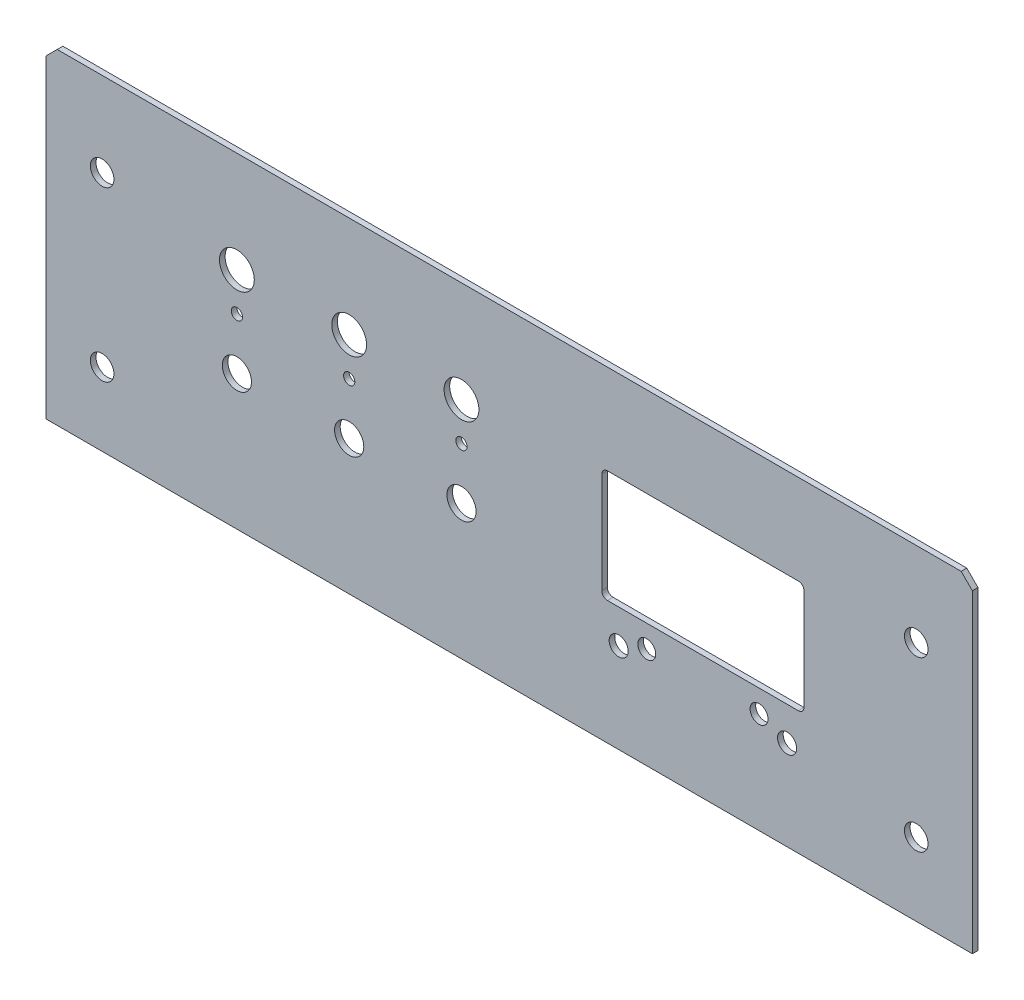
SolidWorks part; units mm, degrees
ref_plane "Front Plane" through (0, 0, 0) normal (0, 0, 1) x (1, 0, 0)
ref_plane "Top Plane" through (0, 0, 0) normal (0, 1, 0) x (1, 0, 0)
ref_plane "Right Plane" through (0, 0, 0) normal (1, 0, 0) x (0, 0, -1)
sketch "Sketch1" plane through (0, 0, 0) normal (0, 0, 1) x (1, 0, 0)
  line L0 (-80.5, 29) -> (-82.5, 27)
  line L1 (-80.5, 29) -> (80.5, 29)
  line L2 (-82.5, 27) -> (-82.5, -29)
  line L3 (-82.5, -29) -> (82.5, -29)
  line L4 (82.5, 27) -> (82.5, -29)
  line L5 (-82.5, 29) -> (82.5, -29) construction
  line L6 (-82.5, -29) -> (82.5, 29) construction
  line L7 (80.5, 29) -> (82.5, 27)
  point P0 (0, 0)
  dimension "D1" = 58
  dimension "D2" = 165
base flange "Base-Flange1" sketch "Sketch1" thickness 1 reverse thickness direction no parameters "D1"=0.7366
sketch "Sketch2" plane through (0, 0, -1) normal (0, 0, -1) x (-1, 0, 0)
  line L0 (-82.5, -29) -> (-82.5, 27) construction
  line L1 (-75, -26) -> (-60, -26) construction
  line L2 (82.5, 27) -> (82.5, -29) construction
  circle A2 centre (72.5, -16) radius 2.1
  circle A3 centre (-72.5, -16) radius 2.1
  circle A4 centre (-72.5, 14) radius 2.1
  circle A5 centre (72.5, 14) radius 2.1
  dimension "D1" = 4.2
  dimension "D2" = 10
  dimension "D3" = 10
  dimension "D4" = 10
  dimension "D5" = 30
extrude "Cut-Extrude1" cut sketch "Sketch2" against normal up to next
sketch "Sketch3" plane through (0, 0, 0) normal (0, 0, 1) x (1, 0, 0)
  line L0 (80.5, 29) -> (-80.5, 29) construction
  line L1 (17.5, 13) -> (51.5, 13)
  line L2 (16.5, 12) -> (16.5, -6)
  line L3 (17.5, -7) -> (51.5, -7)
  line L4 (52.5, 12) -> (52.5, -6)
  line L5 (16.5, 13) -> (52.5, -7) construction
  line L6 (16.5, -7) -> (52.5, 13) construction
  line L7 (-82.5, 27) -> (-82.5, -29) construction
  line L8 (82.5, -29) -> (82.5, 27) construction
  circle A0 centre (-48.5, 11) radius 3.1
  circle A1 centre (-28.5, -5) radius 2.6
  circle A2 centre (-48.5, -5) radius 2.6
  circle A3 centre (-28.5, 4.2) radius 1
  circle A4 centre (24.5, -11) radius 1.6
  circle A5 centre (44.5, -11) radius 1.6
  arc A6 (51.5, 13) -> (52.5, 12) centre (51.5, 12) cw
  arc A7 (52.5, -6) -> (51.5, -7) centre (51.5, -6) cw
  arc A8 (17.5, -7) -> (16.5, -6) centre (17.5, -6) cw
  arc A9 (16.5, 12) -> (17.5, 13) centre (17.5, 12) cw
  circle A10 centre (-48.5, 4.2) radius 1
  circle A11 centre (-28.5, 11) radius 3.1
  circle A12 centre (49.5, -13) radius 1.7
  circle A13 centre (19.5, -13) radius 1.7
  circle A14 centre (-8.5, -5) radius 2.6
  circle A15 centre (-8.5, 4.2) radius 1
  circle A16 centre (-8.5, 11) radius 3.1
  point P12 (34.5, 3)
  dimension "D1" = 6.2
  dimension "D6" = 5.2
  dimension "D12" = 3.2
  dimension "D15" = 1
  dimension "D16" = 2
  dimension "D18" = 3.4
  dimension "D2" = 18
  dimension "D3" = 34
  dimension "D4" = 3
  dimension "D5" = 16
  dimension "D7" = 36
  dimension "D8" = 20
  dimension "D9" = 48
  dimension "D10" = 20
  dimension "D11" = 24
  dimension "D13" = 10
  dimension "D14" = 16
  dimension "D17" = 6.8
  dimension "D19" = 15
  dimension "D20" = 15
  dimension "D21" = 6
  dimension "D22" = 20
extrude "Cut-Extrude2" cut sketch "Sketch3" against normal up to next
sketch "Bend-Lines1" [suppressed] plane through (0, 0, 0) normal (0, 1, 0) x (1, 0, 0)
sketch "Bounding-Box1" [suppressed] plane through (0, 0, 0) normal (0, 1, 0) x (1, 0, 0)
sheet metal parameters "Sheet-Metal1" thickness 1 parameters "D1"=0.7366
flat pattern "Flat-Pattern1"
sketch "Bend-Lines2" plane through (0, 0, 0) normal (0, 1, 0) x (1, 0, 0)
sketch3d "Bounding-Box2" [suppressed]
  line L0 (-75, -28.5, 0) -> (75, -28.5, 0) construction
  line L1 (-75, 28.5, 0) -> (75, 28.5, 0) construction
  line L2 (-75, -28.5, 0) -> (-75, 28.5, 0) construction
  line L3 (75, -28.5, 0) -> (75, 28.5, 0) construction
sheet metal parameters "Sheet-Metal2" thickness 1 parameters "D1"=0.7366
flat pattern "Flat-Pattern1"
sketch "Bend-Lines2" plane through (0, 0, 0) normal (0, 1, 0) x (1, 0, 0)
sketch3d "Bounding-Box2" [suppressed]
  line L0 (-75, -28.5, 0) -> (75, -28.5, 0) construction
  line L1 (-75, 28.5, 0) -> (75, 28.5, 0) construction
  line L2 (-75, -28.5, 0) -> (-75, 28.5, 0) construction
  line L3 (75, -28.5, 0) -> (75, 28.5, 0) construction
sheet metal parameters "Sheet-Metal3" thickness 1 parameters "D1"=0.7366
flat pattern "Flat-Pattern1"
sketch "Bend-Lines2" plane through (0, 0, 0) normal (0, 1, 0) x (1, 0, 0)
sketch3d "Bounding-Box2" [suppressed]
  line L0 (-82.5, -29, 0) -> (82.5, -29, 0) construction
  line L1 (-82.5, 29, 0) -> (82.5, 29, 0) construction
  line L2 (-82.5, -29, 0) -> (-82.5, 29, 0) construction
  line L3 (82.5, -29, 0) -> (82.5, 29, 0) construction
